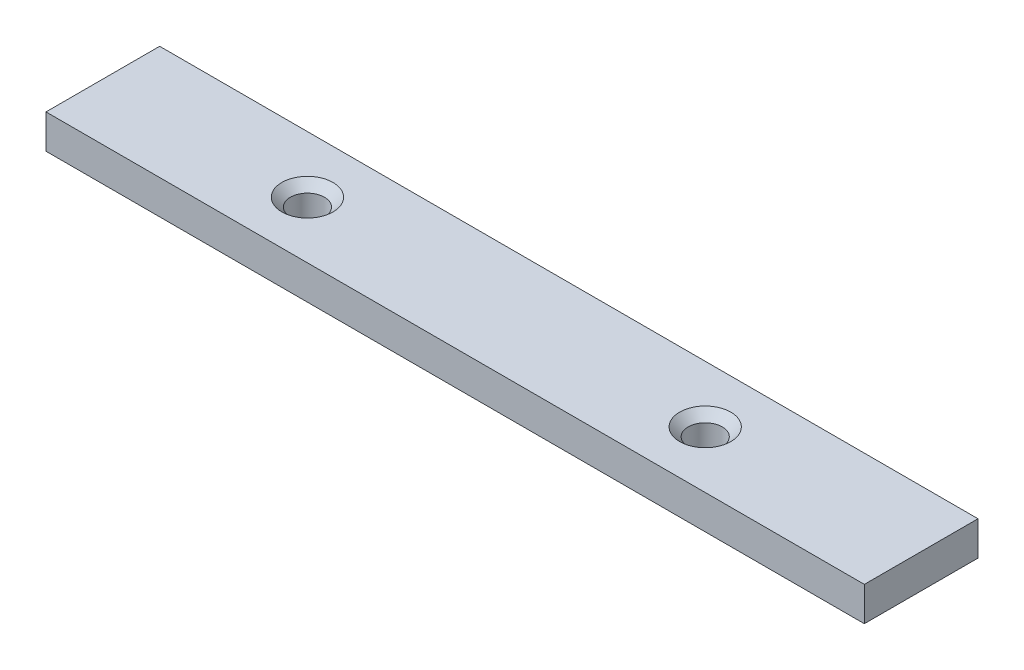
SolidWorks part; units mm, degrees
ref_plane "Front Plane" through (0, 0, 0) normal (0, 0, 1) x (1, 0, 0)
ref_plane "Top Plane" through (0, 0, 0) normal (0, 1, 0) x (1, 0, 0)
ref_plane "Right Plane" through (0, 0, 0) normal (1, 0, 0) x (0, 0, -1)
sketch "Sketch1" plane through (0, 0, 0) normal (0, 1, 0) x (1, 0, 0)
  line L1 (-72, -10) -> (72, -10)
  line L2 (-72, -10) -> (-72, 10)
  line L3 (-72, 10) -> (72, 10)
  line L4 (72, -10) -> (72, 10)
  line L5 (-72, -10) -> (72, 10) construction
  line L6 (-72, 10) -> (72, -10) construction
  point P0 (0, 0)
  dimension "D1" = 144
  dimension "D2" = 20
extrude "Boss-Extrude1" add sketch "Sketch1" along normal blind 6
hole_wizard "CSK for M1.6 Countersunk Flat Head Screw1" positions "Sketch3" profile "Sketch2" countersink size "M1.6" standard "ISO"
sketch "Sketch3" plane through (0, 6, 0) normal (0, 1, 0) x (-1, 0, 0)
  line L0 (-72, 10) -> (-72, -10) construction
  point P0 (36, 0)
  point P1 (-34, 0)
  dimension "D1" = 38
  dimension "D2" = 70
sketch "Sketch2" plane through (-36, 6, 0) normal (1, 0, 0) x (0, 0, 1)
  line L0 (0, 0) -> (0, 6)
  line L1 (0, 6) -> (3, 6)
  line L2 (3, 6) -> (3, 1.5)
  line L3 (3, 1.5) -> (4.5, 0)
  line L5 (4.5, 0) -> (0, 0)
  line L6 (-3, 1.5) -> (-4.5, 0) construction
  line L11 (0, -6.35) -> (0, 107.95) construction
  dimension "Thru Hole Dia." = 6
  dimension "Thru Hole Depth" = 6
  dimension "Near C'Sink Dia." = 9
  dimension "Near C'Sink Angle" = 90
